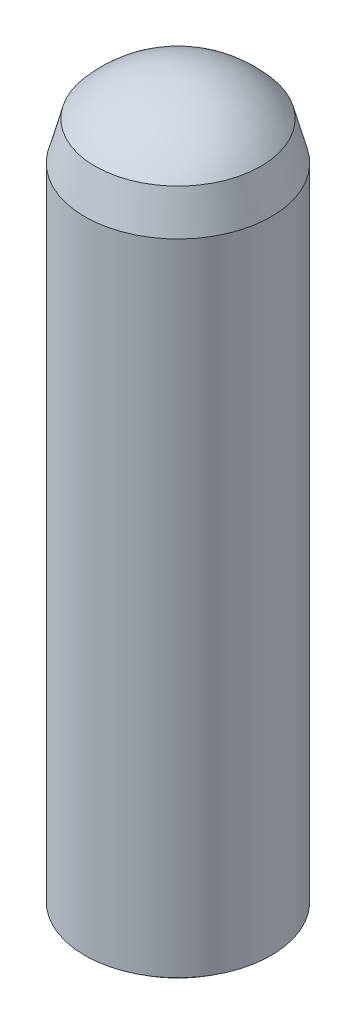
SolidWorks part; units mm, degrees
ref_plane "Vorne" through (0, 0, 0) normal (0, 0, 1) x (1, 0, 0)
ref_plane "Oben" through (0, 0, 0) normal (0, 1, 0) x (1, 0, 0)
ref_plane "Rechts" through (0, 0, 0) normal (1, 0, 0) x (0, 0, -1)
sketch "Skizze1" plane through (0, 0, 0) normal (0, 0, 1) x (1, 0, 0)
  line L0 (0, 0) -> (0, 6) construction
  line L1 (0, 6) -> (0, 0)
  line L2 (0.75, 0.23) -> (0.75, 5.38)
  line L3 (0.75, 5.38) -> (0.6669, 5.69)
  line L4 (0, 0) -> (0.1, 0)
  arc A0 (0.1, 0) -> (0.75, 0.23) centre (0.1, 1.0335) ccw
  arc A1 (0.6669, 5.69) -> (0, 6) centre (0, 5.1276) ccw
  dimension "D1" = 0.31
  dimension "d" = 1.5
  dimension "D2" = 0.2
  dimension "z" = 0.23
  dimension "a" = 0.62
  dimension "Länge" = 6
  dimension "D6" = 15
revolve "Rotation1" add sketch "Skizze1" angle 360 about L0
other "PropertyManager"
equation "\"D1@Skizze1\" = \"a@Skizze1\"/2"
